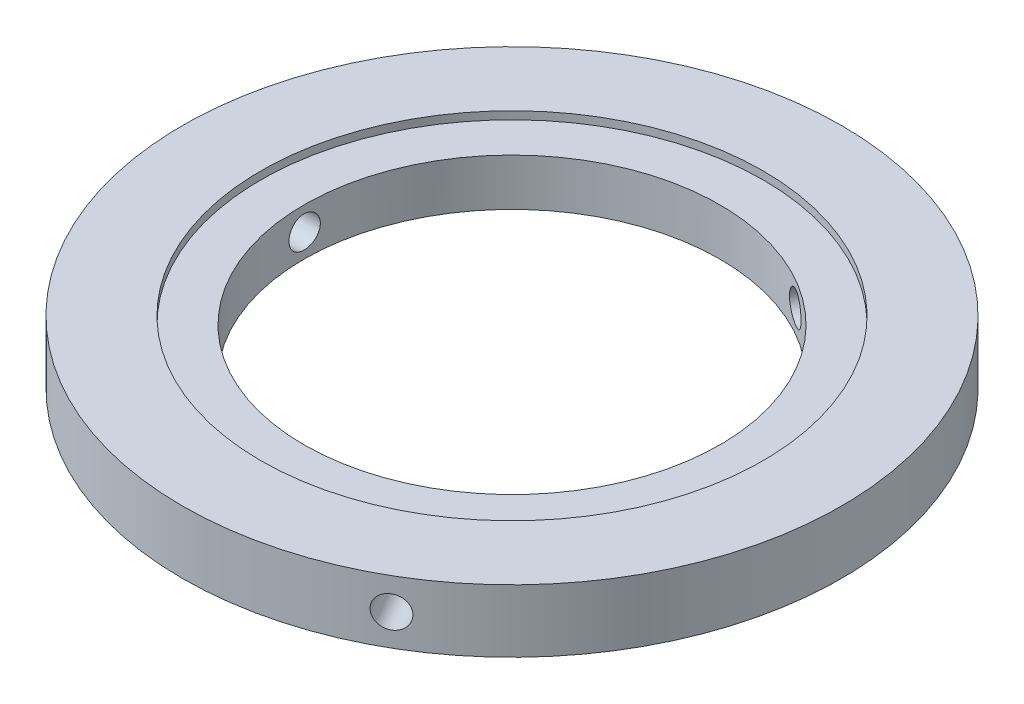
SolidWorks part; units mm, degrees
ref_plane "Front Plane" through (0, 0, 0) normal (0, 0, 1) x (1, 0, 0)
ref_plane "Top Plane" through (0, 0, 0) normal (0, 1, 0) x (1, 0, 0)
ref_plane "Right Plane" through (0, 0, 0) normal (1, 0, 0) x (0, 0, -1)
sketch "Sketch1" plane through (0, 0, 0) normal (0, 1, 0) x (1, 0, 0)
  circle A0 centre (0, 0) radius 21
  dimension "D1" = 42
extrude "Boss-Extrude1" add sketch "Sketch1" along normal blind 4
hole_wizard "M30 Tapped Hole1" positions "Sketch3" profile "Sketch2" tap size "M30" standard "DIN"
sketch "Sketch3" plane through (0, 4, 0) normal (0, 1, 0) x (1, 0, 0)
  point P0 (0, 0)
sketch "Sketch2" plane through (0, 4, 0) normal (1, 0, 0) x (0, 0, 1)
  line L0 (0, 0) -> (0, 4)
  line L1 (0, 4) -> (13.25, 4)
  line L2 (13.25, 4) -> (13.25, 0)
  line L5 (13.25, 0) -> (0, 0)
  line L11 (0, -6.35) -> (0, 107.95) construction
  dimension "Thru Tap Drill Dia." = 26.5
  dimension "Thru Tap Drill Depth" = 4
sketch "Sketch4" plane through (0, 0, 0) normal (1, 0, 0) x (0, 0, -1)
  line L0 (-21, 0) -> (21, 0) construction
  circle A0 centre (0, 2) radius 1
  dimension "D1" = 2
  dimension "D2" = 2
extrude "Cut-Extrude1" cut sketch "Sketch4" against normal up to surface (20.9762 mm away)
pattern_circular "CirPattern1" count 3 over 360 about axis through (0, 4, 0) along (0, -1, 0) of "Cut-Extrude1"
sketch "Sketch5" plane through (0, 4, 0) normal (0, 1, 0) x (1, 0, 0)
  circle A0 centre (0, 0) radius 16
  dimension "D1" = 32
extrude "Cut-Extrude3" cut sketch "Sketch5" against normal blind 0.5
sketch "Sketch6" plane through (0, 0, 0) normal (0, -1, 0) x (1, 0, 0)
  circle A0 centre (0, 0) radius 16
  dimension "D1" = 32
extrude "Cut-Extrude4" cut sketch "Sketch6" against normal blind 0.5
